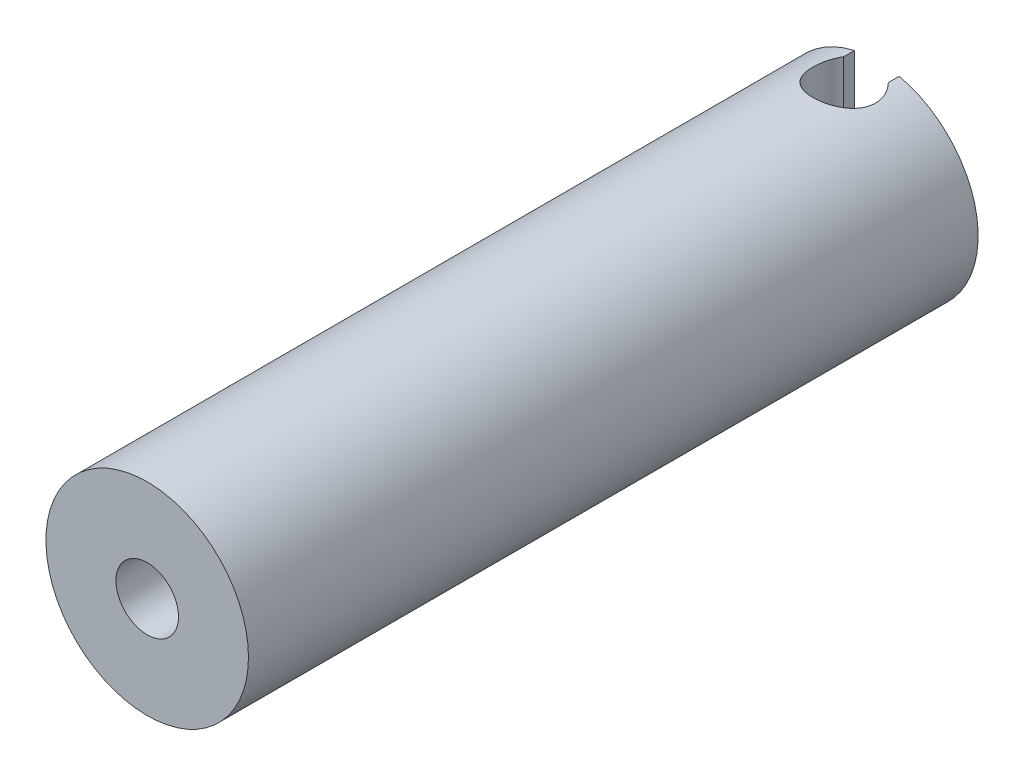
SolidWorks part; units mm, degrees
ref_plane "Plan de face" through (0, 0, 0) normal (0, 0, 1) x (1, 0, 0)
ref_plane "Plan de dessus" through (0, 0, 0) normal (0, 1, 0) x (1, 0, 0)
ref_plane "Plan de droite" through (0, 0, 0) normal (1, 0, 0) x (0, 0, -1)
sketch "Esquisse1" plane through (0, 0, 0) normal (0, 0, 1) x (1, 0, 0)
  circle A0 centre (0, 0) radius 6.8
  dimension "D1" = 13.6
extrude "Boss.-Extru.1" add sketch "Esquisse1" along normal blind 49
sketch "Esquisse2" plane through (0, 0, 49) normal (0, 0, 1) x (1, 0, 0)
  circle A0 centre (0, 0) radius 2.1
  dimension "D1" = 4.2
extrude "Enlèv. mat.-Extru.1" cut sketch "Esquisse2" against normal through all contours A0
sketch "Esquisse3" plane through (0, 0, 0) normal (1, 0, 0) x (0, 0, -1)
  line L3 (-48.4222, -8.4693) -> (-50.4222, -8.4693)
  line L4 (-48.4222, -8.4693) -> (-48.4222, 8.4693)
  line L5 (-48.4222, 8.4693) -> (-50.4222, 8.4693)
  line L6 (-50.4222, -8.4693) -> (-50.4222, 8.4693)
  line L7 (-48.4222, -8.4693) -> (-50.4222, 8.4693) construction
  line L8 (-48.4222, 8.4693) -> (-50.4222, -8.4693) construction
  point P3 (-49.4222, 0)
  dimension "D1" = 2
ref_plane "Plan1" through (0, 10, 0) normal (0, 1, 0) x (1, 0, 0)
sketch "Esquisse4" plane through (0, 10, 0) normal (0, 1, 0) x (1, 0, 0)
  circle A0 centre (0, -2.2) radius 2.1
  dimension "D1" = 4.2
  dimension "D2" = 2.2
extrude "Enlèv. mat.-Extru.9" cut sketch "Esquisse4" against normal blind 9
sketch "Esquisse5" plane through (0, 0, 0) normal (0, 0, -1) x (-1, 0, 0)
  line L1 (1.5, -8.5104) -> (-1.5, -8.5104)
  line L2 (1.5, -8.5104) -> (1.5, 8.5104)
  line L3 (1.5, 8.5104) -> (-1.5, 8.5104)
  line L4 (-1.5, -8.5104) -> (-1.5, 8.5104)
  line L5 (1.5, -8.5104) -> (-1.5, 8.5104) construction
  line L6 (1.5, 8.5104) -> (-1.5, -8.5104) construction
  point P0 (0, 0)
  dimension "D1" = 3
extrude "Enlèv. mat.-Extru.10" cut sketch "Esquisse5" against normal blind 1.5
